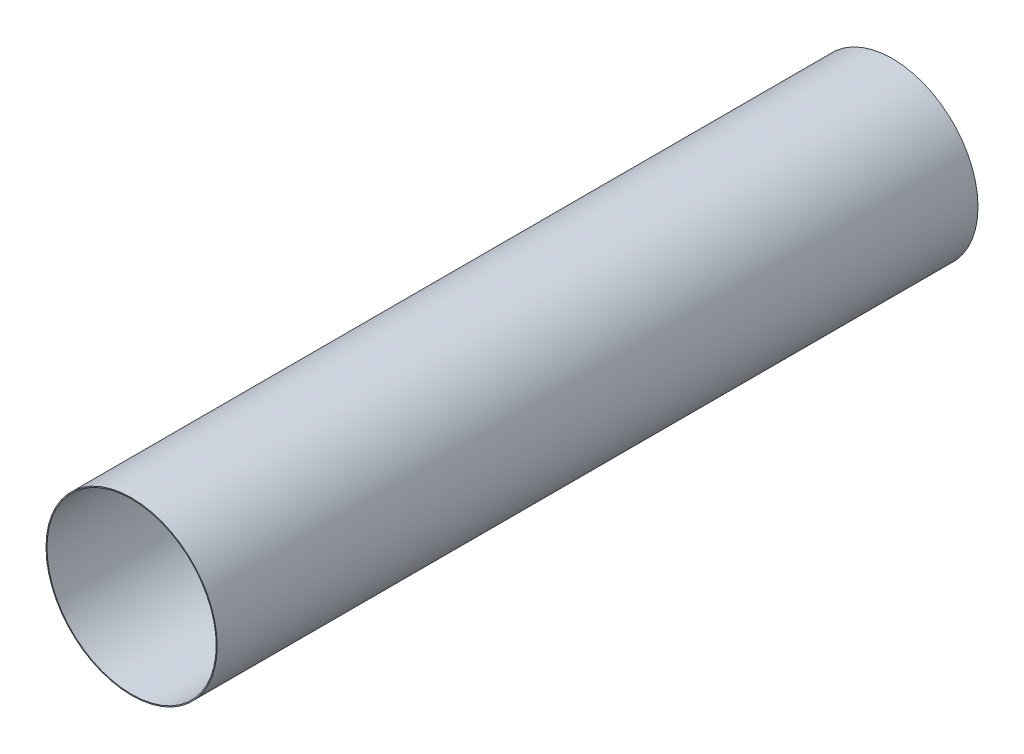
SolidWorks part; units mm, degrees
ref_plane "Plan de face" through (0, 0, 0) normal (0, 0, 1) x (1, 0, 0)
ref_plane "Plan de dessus" through (0, 0, 0) normal (0, 1, 0) x (1, 0, 0)
ref_plane "Plan de droite" through (0, 0, 0) normal (1, 0, 0) x (0, 0, -1)
sketch "Esquisse1" plane through (0, 0, 0) normal (0, 0, 1) x (1, 0, 0)
  circle A0 centre (0, 0) radius 90
  circle A1 centre (0, 0) radius 89
  dimension "D1" = 180
  dimension "D2" = 1
extrude "Boss.-Extru.1" add sketch "Esquisse1" along normal blind 800
